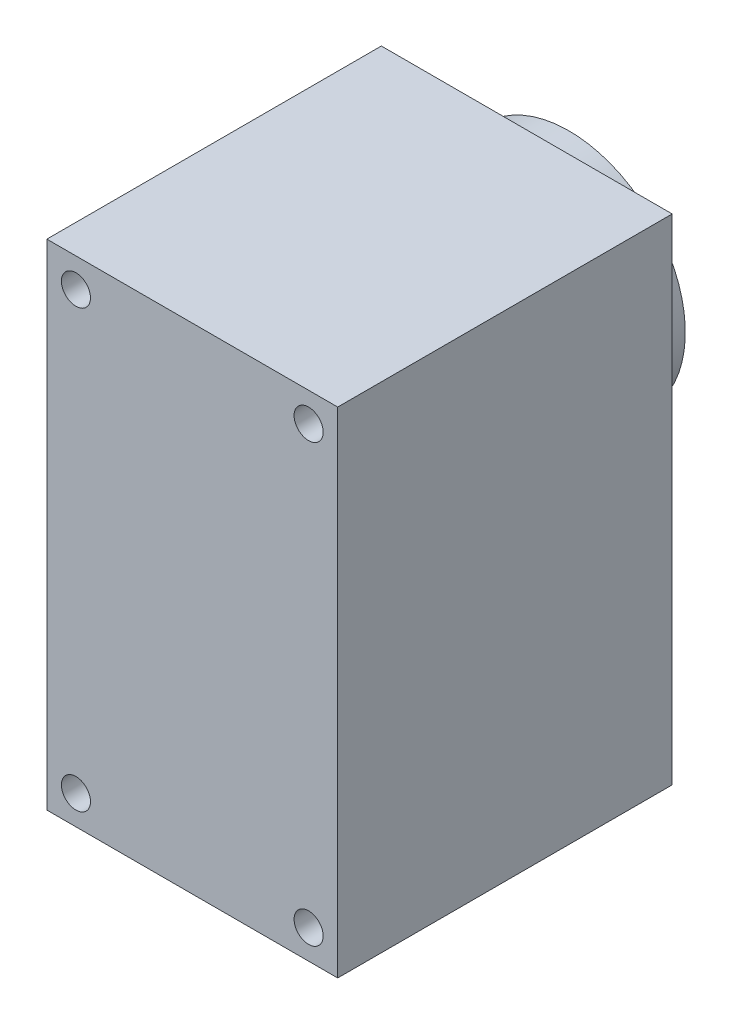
SolidWorks part; units mm, degrees
ref_plane "Front Plane" through (0, 0, 0) normal (0, 0, 1) x (1, 0, 0)
ref_plane "Top Plane" through (0, 0, 0) normal (0, 1, 0) x (1, 0, 0)
ref_plane "Right Plane" through (0, 0, 0) normal (1, 0, 0) x (0, 0, -1)
sketch "Sketch1" plane through (0, 0, 0) normal (0, 0, 1) x (1, 0, 0)
  line L0 (-3.5934, -2.7317) -> (16.4066, -2.7317) construction
  line L1 (6.4066, -2.7317) -> (6.4066, 5.0771) construction
  line L2 (16.4066, -19.7317) -> (16.4066, 14.2683)
  line L3 (16.4066, 14.2683) -> (-3.5934, 14.2683)
  line L4 (-3.5934, 14.2683) -> (-3.5934, -19.7317)
  line L9 (16.4066, -19.7317) -> (-3.5934, -19.7317)
  line L10 (-1.5934, 12.2683) -> (14.4066, 12.2683) construction
  line L11 (14.4066, 12.2683) -> (14.4066, -17.7317) construction
  circle A4 centre (-1.5934, 12.2683) radius 1
  circle A5 centre (14.4066, 12.2683) radius 1
  circle A6 centre (-1.5934, -17.7317) radius 1
  circle A7 centre (14.4066, -17.7317) radius 1
  dimension "D1" = 2
  dimension "D2" = 16
  dimension "D3" = 30
  dimension "D4" = 20
  dimension "D5" = 34
extrude "Boss-Extrude1" add sketch "Sketch1" along normal blind 23
sketch "Sketch2" plane through (0, 0, 0) normal (0, 0, -1) x (-1, 0, 0)
  line L0 (-6.4066, -19.7317) -> (-6.4066, 20.301) construction
  line L1 (3.5934, -19.7317) -> (-16.4066, -19.7317) construction
  line L2 (-16.4066, 14.2683) -> (3.5934, 14.2683) construction
  line L3 (-14.4066, 4.7683) -> (1.5934, 4.7683) construction
  circle A0 centre (-6.4066, 4.7683) radius 8
  circle A1 centre (-6.4066, 10.7683) radius 1
  circle A2 centre (-12.4066, 4.7683) radius 1
  circle A3 centre (-6.4066, -1.2317) radius 1
  circle A4 centre (-0.4066, 4.7683) radius 1
  circle A5 centre (-6.4066, 4.7683) radius 1
  dimension "D1" = 16
  dimension "D3" = 2
  dimension "D2" = 9.5
  dimension "D4" = 12
  dimension "D5" = 12
extrude "Boss-Extrude2" add sketch "Sketch2" along normal blind 2.9
sketch "Sketch4" plane through (0, 0, -2.9) normal (0, 0, -1) x (-1, 0, 0)
  circle A0 centre (-6.4066, 10.7683) radius 1 construction
  circle A1 centre (-0.4066, 4.7683) radius 1 construction
  circle A2 centre (-6.4066, -1.2317) radius 1 construction
  circle A3 centre (-12.4066, 4.7683) radius 1 construction
  circle A4 centre (-6.4066, 4.7683) radius 1 construction
  circle A5 centre (-6.4066, 4.7683) radius 8 construction
  circle A6 centre (-6.4066, 10.7683) radius 1
  circle A7 centre (-0.4066, 4.7683) radius 1
  circle A8 centre (-6.4066, -1.2317) radius 1
  circle A9 centre (-12.4066, 4.7683) radius 1
  circle A10 centre (-6.4066, 4.7683) radius 1
  circle A11 centre (-6.4066, 4.7683) radius 8
